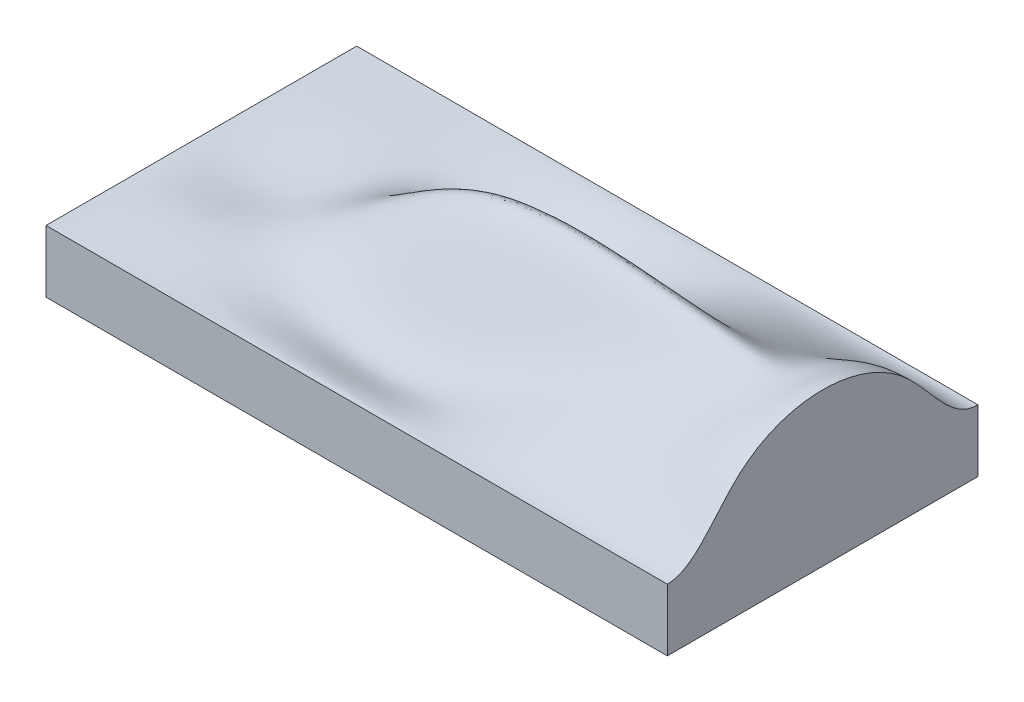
SolidWorks part; units mm, degrees
ref_plane "Front Plane" through (0, 0, 0) normal (0, 0, 1) x (1, 0, 0)
ref_plane "Top Plane" through (0, 0, 0) normal (0, 1, 0) x (1, 0, 0)
ref_plane "Right Plane" through (0, 0, 0) normal (1, 0, 0) x (0, 0, -1)
sketch "Sketch1" plane through (0, 0, 0) normal (0, 1, 0) x (1, 0, 0)
  line L1 (-127, -63.5) -> (127, -63.5)
  line L2 (-127, -63.5) -> (-127, 63.5)
  line L3 (-127, 63.5) -> (127, 63.5)
  line L4 (127, -63.5) -> (127, 63.5)
  line L5 (-127, -63.5) -> (127, 63.5) construction
  line L6 (-127, 63.5) -> (127, -63.5) construction
  point P0 (0, 0)
  dimension "D1" = 254
  dimension "D2" = 127
extrude "Boss-Extrude1" add sketch "Sketch1" along normal blind 25.4
other "Freeform1"
